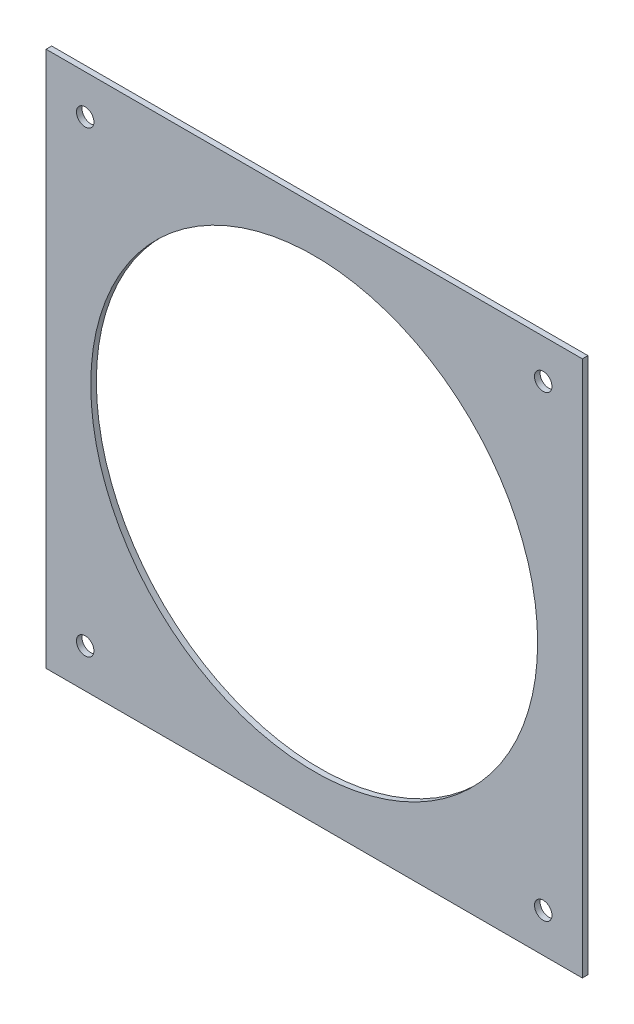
SolidWorks part; units mm, degrees
ref_plane "Front" through (0, 0, 0) normal (0, 0, 1) x (1, 0, 0)
ref_plane "Top" through (0, 0, 0) normal (0, 1, 0) x (1, 0, 0)
ref_plane "Right" through (0, 0, 0) normal (1, 0, 0) x (0, 0, -1)
sketch "Sketch1" plane through (0, 0, 0) normal (0, 0, 1) x (1, 0, 0)
  line L1 (0, 0) -> (304.8, 0)
  line L2 (0, 0) -> (0, 304.8)
  line L3 (0, 304.8) -> (304.8, 304.8)
  line L4 (304.8, 0) -> (304.8, 304.8)
  circle A0 centre (152.4, 152.4) radius 127
  dimension "D3" = 254
  dimension "D1" = 304.8
  dimension "D2" = 304.8
extrude "Boss-Extrude1" add sketch "Sketch1" along normal blind 3.175
hole_wizard "25/64 (0.39063) Diameter Hole1" positions "Sketch2" profile "Sketch3" hole size "25/64" standard "ANSI Inch"
sketch "Sketch2" plane through (0, 0, 3.175) normal (0, 0, 1) x (1, 0, 0)
  line L0 (0, 304.8) -> (0, 0) construction
  line L1 (0, 0) -> (304.8, 0) construction
  point P0 (22.225, 282.575)
  point P2 (282.575, 282.575)
  point P4 (282.575, 22.225)
  point P6 (22.225, 22.225)
  dimension "D1" = 260.35
  dimension "D2" = 260.35
  dimension "D3" = 22.225
  dimension "D4" = 22.225
sketch "Sketch3" plane through (22.225, 282.575, 3.175) normal (1, 0, 0) x (0, -1, 0)
  line L0 (0, 0) -> (0, 3.175)
  line L1 (0, 3.175) -> (4.961, 3.175)
  line L2 (4.961, 3.175) -> (4.961, 0)
  line L5 (4.961, 0) -> (0, 0)
  line L11 (0, -6.35) -> (0, 107.95) construction
  dimension "Thru Hole Dia." = 9.922
  dimension "Thru Hole Depth" = 3.175
sketch "Sketch4" plane through (0, 0, 3.175) normal (0, 0, 1) x (1, 0, 0)
  circle A0 centre (152.4, 152.4) radius 127
  circle A1 centre (152.4, 152.4) radius 123.825
  dimension "D1" = 247.65
  dimension "D2" = 254
extrude "3D prinyt single part extrusion" [suppressed] add sketch "Sketch4" along normal blind 111.125 separate body
